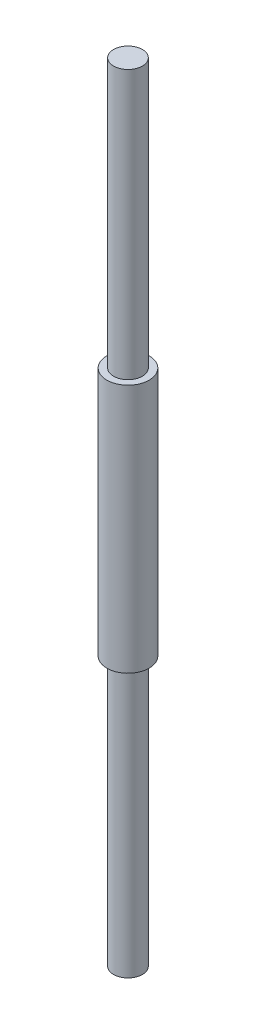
SolidWorks part; units mm, degrees
ref_plane "Front Plane" through (0, 0, 0) normal (0, 0, 1) x (1, 0, 0)
ref_plane "Top Plane" through (0, 0, 0) normal (0, 1, 0) x (1, 0, 0)
ref_plane "Right Plane" through (0, 0, 0) normal (1, 0, 0) x (0, 0, -1)
sketch "Sketch1" plane through (0, 0, 0) normal (0, 1, 0) x (1, 0, 0)
  circle A0 centre (0, 0) radius 9.525
extrude "Boss-Extrude1" add sketch "Sketch1" along normal blind 177.8
sketch "Sketch2" plane through (0, 177.8, 0) normal (0, 1, 0) x (1, 0, 0)
  circle A0 centre (0, 0) radius 13.97
extrude "Boss-Extrude2" add sketch "Sketch2" along normal blind 165.1
sketch "Sketch3" plane through (0, 342.9, 0) normal (0, 1, 0) x (1, 0, 0)
  circle A0 centre (0, 0) radius 9.525
extrude "Boss-Extrude3" add sketch "Sketch3" along normal blind 177.8
